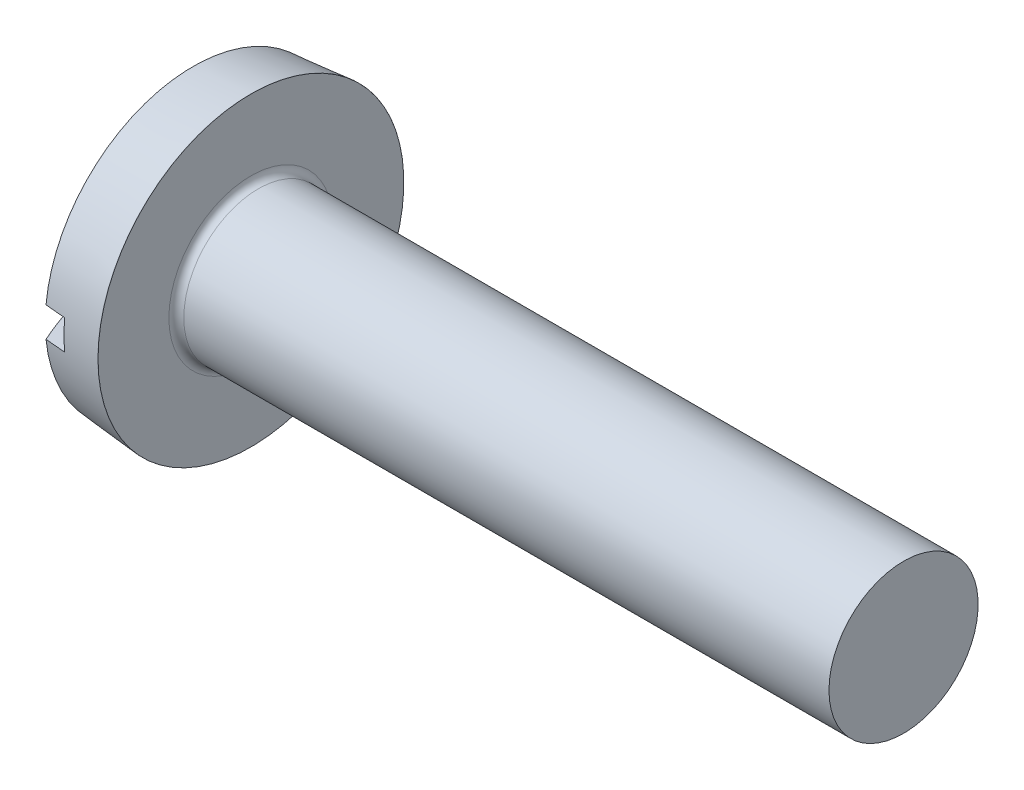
SolidWorks part; units mm, degrees
ref_plane "Plane1" through (0, 0, 0) normal (0, 0, 1) x (1, 0, 0)
ref_plane "Plane2" through (0, 0, 0) normal (0, 1, 0) x (1, 0, 0)
ref_plane "Plane3" through (0, 0, 0) normal (1, 0, 0) x (0, 0, -1)
sketch "BodySke" plane through (0, 0, 0) normal (0, 0, 1) x (1, 0, 0)
  line L0 (4.8, 4) -> (4.8, 8.2)
  line L1 (4.8, 8.2) -> (4.79, 8.2)
  line L2 (-25.4, 0) -> (127, 0) construction
  line L4 (4.8, 4) -> (39.8, 4)
  line L5 (39.8, 4) -> (39.8, 0)
  line L6 (39.8, 0) -> (0, 0)
  line L7 (4.8, -4) -> (39.8, -4) construction
  line L8 (6.05, 6.35) -> (6.05, -3.175) construction
  line L9 (9.8, 6.35) -> (9.8, -3.175) construction
  line L10 (4.79, 8.2) -> (1.7, 7.9297)
  arc A0 (0, 0) -> (1.7, 7.9297) centre (19.344, 0) cw
  dimension "D1" = 0.01
  dimension "Head_ang" = 85
  dimension "Oval_ht" = 1.7
  dimension "Head_ht" = 4.8
  dimension "Diameter" = 8
  dimension "Length" = 35
  dimension "Head_dia" = 16.4
  dimension "Advance" = 1.25
  dimension "Thread_nom" = 30
revolve "Base-Revolve" add sketch "BodySke"
fillet "Fillet1" radius 0.4 1 edges at (4.8, 0, 4)
sketch "Sketch2" plane through (0, 0, 0) normal (1, 0, 0) x (0, 0, -1)
  line L0 (8.2, -0.8) -> (8.2, 0.8)
  line L1 (8.2, 0.8) -> (-8.2, 0.8)
  line L2 (-8.2, 0.8) -> (-8.2, -0.8)
  line L3 (-8.2, -0.8) -> (8.2, -0.8)
  dimension "D1" = 16.4
  dimension "D2" = 8.2
  dimension "D3" = 0.8
  dimension "Slot_width" = 1.6
extrude "Slot" cut sketch "Sketch2" along normal blind 2.8
sketch "ThdSchSke" plane through (0, 0, 0) normal (0, 0, 1) x (1, 0, 0)
  line L0 (9.8, -3.3095) -> (9.3165, -4)
  line L1 (9.8, -3.3095) -> (10.2835, -4)
  line L2 (10.2835, -4) -> (10.2835, -5)
  line L3 (-3.175, 0) -> (5.1513, 0) construction
  line L5 (10.2835, -5) -> (9.3165, -5)
  line L6 (9.3165, -5) -> (9.3165, -4)
  dimension "Thread_minor" = 6.619
  dimension "Diameter" = 8
  dimension "Start" = 9.8
  dimension "SideAngle" = 55
  dimension "VeeAngle" = 70
  dimension "Overcut" = 10
revolve "ThreadSchematic" [suppressed] cut sketch "ThdSchSke" angle 360 about L3
pattern_linear "ThdSchPat" [suppressed]
equation "' \"Diameter@BodySke\" = 8"
equation "' \"Length@BodySke\" = 35"
equation "' \"Head_dia@BodySke\" = 16.4"
equation "' \"Oval_ht@BodySke\" = 1.7"
equation "' \"Head_ht@BodySke\" = 4.8"
equation "' \"Thread_nom@BodySke\" =  30"
equation "' \"Head_ang@BodySke\" = 85"
equation "' \"Slot_width@Sketch2\" = 1.6"
equation "' \"Slot_depth@Slot\" = 2.8"
equation "' \"Thread_minor@ThreadCosmetic\" = 6.619"
equation "' \"Advance@BodySke\" = 1.25"
equation "\"D1@Sketch2\" = \"Head_dia@BodySke\""
equation "\"D2@Sketch2\" = \"D1@Sketch2\" / 2"
equation "\"D3@Sketch2\" = \"Slot_width@Sketch2\" / 2"
equation "\"Thread_length@ThreadCosmetic\" = ((sgn( (\"Length@BodySke\" - \"Advance@BodySke\" * 2 ) - \"Thread_nom@BodySke\" )-1)*( (\"Length@BodySke\" - \"Advance@BodySke\" * 2 ) - \"Thread_nom@BodySke\" ))/-2+ \"Thread_nom@"
equation "\"Thread_minor@ThdSchSke\" = \"Thread_minor@ThreadCosmetic\""
equation "\"Diameter@ThdSchSke\" = \"Diameter@BodySke\""
equation "\"Overcut@ThdSchSke\" = \"Diameter@BodySke\" * 1.25"
equation "\"Start@ThdSchSke\" = \"Head_ht@BodySke\" + \"Length@BodySke\" - \"Thread_length@ThreadCosmetic\"  '---Non-countersunk---"
equation "\"Num_threads@ThdSchPat\" = int( \"Thread_length@ThreadCosmetic\" / \"Advance@BodySke\" + 0.999 )  + 1"
equation "\"Advance@ThdSchPat\" = \"Thread_length@ThreadCosmetic\" /  (\"Num_threads@ThdSchPat\" - 1) 'relax it"
